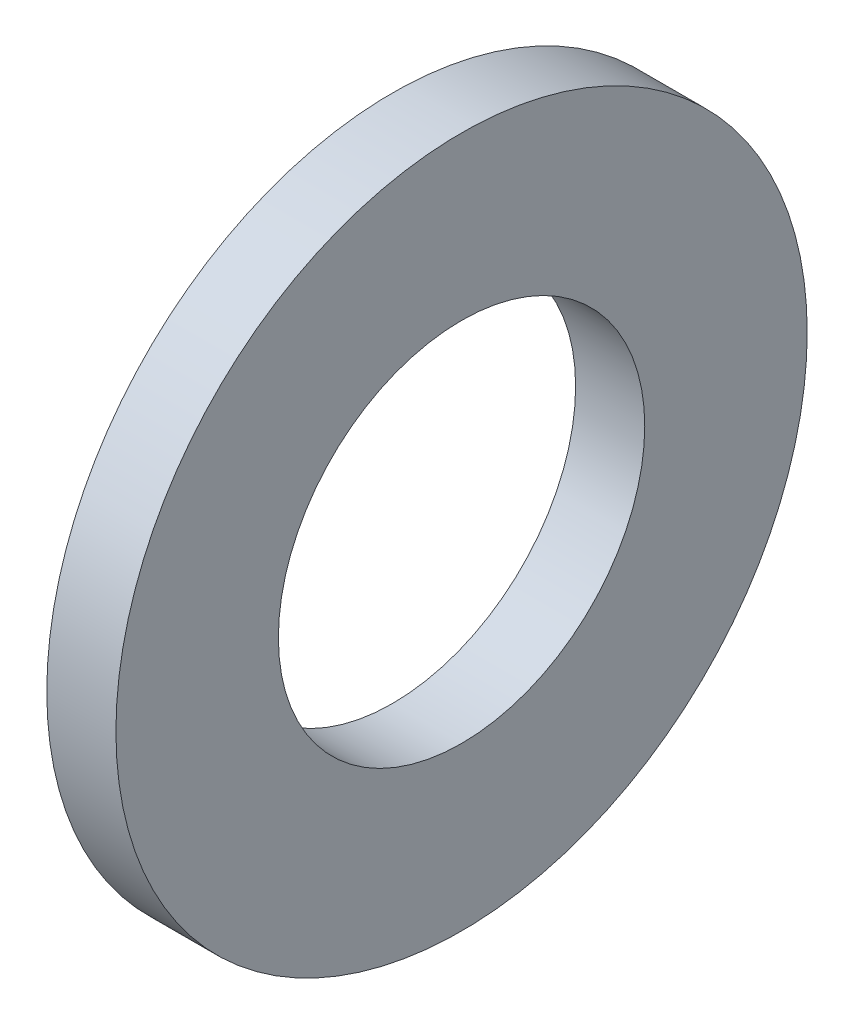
SolidWorks part; units mm, degrees
ref_plane "Plan1" through (0, 0, 0) normal (0, 0, 1) x (1, 0, 0)
ref_plane "Plan2" through (0, 0, 0) normal (0, 1, 0) x (1, 0, 0)
ref_plane "Plan3" through (0, 0, 0) normal (1, 0, 0) x (0, 0, -1)
sketch "Esquisse1" plane through (0, 0, 0) normal (0, 1, 0) x (1, 0, 0)
  line L0 (0, 0) -> (40, 0) construction
  line L2 (0, 5) -> (1, 5)
  line L3 (0, 5) -> (0, 2.65)
  line L4 (0, 2.65) -> (1, 2.65)
  line L5 (1, 5) -> (1, 2.65)
  dimension "D1" = 2.65
  dimension "D2" = 5
  dimension "D3" = 1
revolve "Base-Révolution" add sketch "Esquisse1" angle 360 about L0
